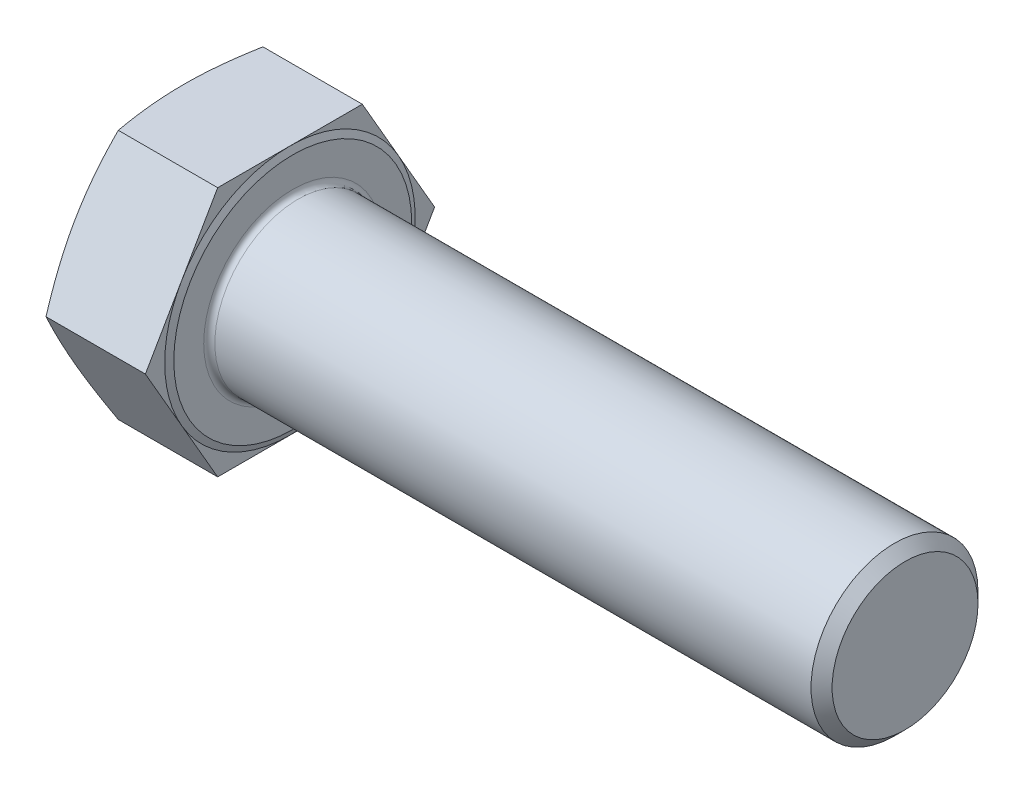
SolidWorks part; units mm, degrees
ref_plane "Front" through (0, 0, 0) normal (0, 0, 1) x (1, 0, 0)
ref_plane "Top" through (0, 0, 0) normal (0, 1, 0) x (1, 0, 0)
ref_plane "Right" through (0, 0, 0) normal (1, 0, 0) x (0, 0, -1)
sketch "Sketch-BaseHead" plane through (0, 0, 0) normal (1, 0, 0) x (0, 0, -1)
  line L1 (25.9808, 0) -> (12.9904, 22.5)
  line L2 (12.9904, 22.5) -> (-12.9904, 22.5)
  line L3 (-12.9904, 22.5) -> (-25.9808, 0)
  line L4 (-25.9808, 0) -> (-12.9904, -22.5)
  line L5 (-12.9904, -22.5) -> (12.9904, -22.5)
  line L6 (12.9904, -22.5) -> (25.9808, 0)
  circle A0 centre (0, 0) radius 22.5 construction
  dimension "s" = 45
extrude "BaseHead" add sketch "Sketch-BaseHead" along normal blind 19.12
sketch "Sketch4" plane through (-0.2646, 0, 5.9169) normal (0, 1, 0) x (0, 0, -1)
  line L0 (5.9169, 3.7369) -> (5.9169, -10.4477) construction
  line L2 (31.8977, -0.2646) -> (28.4169, -0.2646)
  line L4 (28.4169, -0.2646) -> (31.8977, -1.5315)
  line L6 (31.8977, -1.5315) -> (31.8977, -0.2646)
  dimension "D1" = 20
  dimension "D2" = 45
revolve "HeadChamfer" cut sketch "Sketch4" angle 360 about L0
sketch "Sketch1" plane through (0, 0, 0) normal (0, 0, 1) x (1, 0, 0)
  line L0 (19.12, 0) -> (19.62, 0)
  line L1 (19.62, 0) -> (19.62, -21.375)
  line L2 (19.62, -21.375) -> (19.12, -22.5)
  line L3 (19.12, -22.5) -> (19.12, 0) construction
  line L4 (0, 0) -> (7.5821, 0) construction
  line L5 (-4.0016, 0) -> (10.1831, 0) construction
  line L6 (19.12, -22.5) -> (1.2669, -22.5) construction
  line L7 (19.12, 0) -> (19.12, -22.5)
  dimension "D1" = 22.5
  dimension "c" = 0.5
  dimension "D2" = 21.375
revolve "Revolve1" add sketch "Sketch1" angle 360 about axis through (-4.0016, 0, 0) along (1, 0, 0)
ref_plane "Plane2" through (63.62, 0, 0) normal (1, 0, 0) x (0, 0, -1)
sketch "Sketch3" plane through (19.62, 0, 0) normal (1, 0, 0) x (0, 0, -1)
  circle A0 centre (0, 0) radius 15
  dimension "d" = 30
extrude "BaseBody" add sketch "Sketch3" along normal blind 110
fillet "HeadFillet" radius 1 1 edges at (19.62, 0, -15)
chamfer "Chamfer1" distance 1.8945 angle 45 1 edges at (129.62, 0, -15)
equation "\"D1@Sketch1\" = \"s@Sketch-BaseHead\"/ 2"
equation "\"D2@Sketch4\" = \"s@Sketch-BaseHead\""
equation "\"D1@Chamfer1\" =  ( \"d@Sketch3\" - \"D2@ThreadCosmetic1\" ) / 2 "
equation "\"b@ThreadCosmetic1\" = \"l@BaseBody\" - \"lg@Plane2\""
